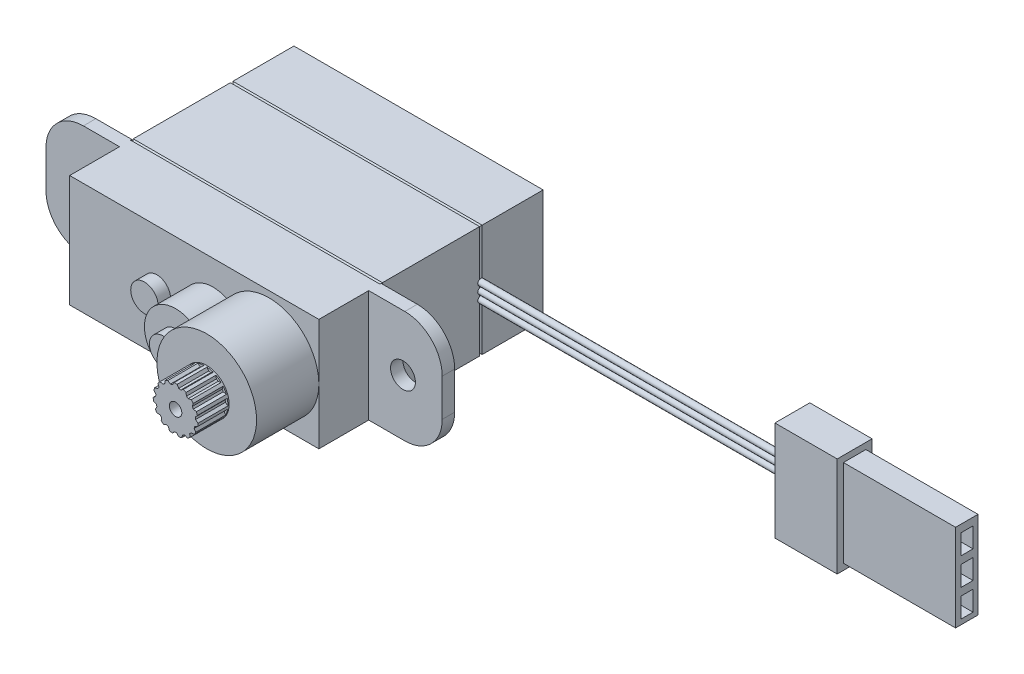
SolidWorks part; units mm, degrees
ref_plane "前视基准面" through (0, 0, 0) normal (0, 0, 1) x (1, 0, 0)
ref_plane "上视基准面" through (0, 0, 0) normal (0, 1, 0) x (1, 0, 0)
ref_plane "右视基准面" through (0, 0, 0) normal (1, 0, 0) x (0, 0, -1)
sketch "草图1" plane through (0, 0, 0) normal (0, 0, 1) x (1, 0, 0)
  line L1 (-10, 4.5) -> (10, 4.5)
  line L2 (-10, 4.5) -> (-10, -4.5)
  line L3 (-10, -4.5) -> (10, -4.5)
  line L4 (10, 4.5) -> (10, -4.5)
  dimension "D1" = 4.5
  dimension "D2" = 9
  dimension "D3" = 10
  dimension "D4" = 20
extrude "凸台-拉伸1" add sketch "草图1" along normal blind 5
chamfer "倒角1" distance 0.1 angle 45 4 edges at (10, 0, 5) (0, -4.5, 5) (-10, 0, 5) (0, 4.5, 5)
sketch "草图2" plane through (0, 0, 5) normal (0, 0, 1) x (1, 0, 0)
  line L0 (10, -4.5) -> (-10, -4.5) construction
  line L1 (10, 4.5) -> (10, -4.5) construction
  line L2 (-10, -4.5) -> (-10, 4.5) construction
  line L3 (-10, 4.5) -> (10, 4.5) construction
  line L6 (10, -4.5) -> (-10, -4.5)
  line L12 (10, 4.5) -> (10, -4.5)
  line L13 (-10, -4.5) -> (-10, 4.5)
  line L14 (-10, 4.5) -> (10, 4.5)
extrude "凸台-拉伸2" add sketch "草图2" along normal blind 8
chamfer "倒角2" distance 0.1 angle 45 4 edges at (0, 4.5, 5) (10, 0, 5) (-10, 0, 5) (0, -4.5, 5)
chamfer "倒角3" distance 0.1 angle 45 4 edges at (0, -4.5, 13) (-10, 0, 13) (0, 4.5, 13) (10, 0, 13)
sketch "草图3" plane through (0, 0, 13) normal (0, 0, 1) x (1, 0, 0)
  line L0 (10, 4.5) -> (10, -4.5) construction
  line L1 (10, -4.5) -> (-10, -4.5) construction
  line L2 (-10, -4.5) -> (-10, 4.5) construction
  line L3 (-10, 4.5) -> (10, 4.5) construction
  line L4 (10, 4.5) -> (10, -4.5)
  line L5 (10, -4.5) -> (-10, -4.5)
  line L6 (-10, -4.5) -> (-10, 4.5)
  line L7 (-10, 4.5) -> (10, 4.5)
extrude "凸台-拉伸3" add sketch "草图3" along normal blind 5
chamfer "倒角4" distance 0.1 angle 45 4 edges at (-10, 0, 13) (0, 4.5, 13) (10, 0, 13) (0, -4.5, 13)
ref_plane "基准面1" through (0, 0, 13) normal (0, 0, 1) x (1, 0, 0)
sketch "草图4" plane through (0, 0, 13) normal (0, 0, 1) x (1, 0, 0)
  line L2 (-15.9, 4.5) -> (-15.9, -4.5)
  line L3 (10, -4.5) -> (15.9, -4.5)
  line L4 (15.9, 4.5) -> (15.9, -4.5)
  line L5 (-10, 4.5) -> (-15.9, 4.5)
  line L6 (-10, -4.5) -> (-15.9, -4.5)
  line L7 (10, 4.5) -> (15.9, 4.5)
  line L10 (10, -4.5) -> (10, 4.5) construction
  line L11 (10, -4.5) -> (10, 4.5)
  line L12 (-10, 4.5) -> (-10, -4.5) construction
  line L13 (-10, 4.5) -> (-10, -4.5)
  circle A0 centre (-12.75, 0) radius 1
  circle A1 centre (12.75, 0) radius 1
  point P0 (0, 4.5)
  point P1 (0, -7.4084)
  point P6 (-15.9, -7.4084)
  dimension "D5" = 2
extrude "凸台-拉伸4" add sketch "草图4" along normal blind 1
fillet "圆角1" radius 3 4 edges at (-15.9, -4.5, 13.5) (-15.9, 4.5, 13.5) (15.9, -4.5, 13.5) (15.9, 4.5, 13.5)
sketch "草图5" plane through (0, 0, 18) normal (0, 0, 1) x (1, 0, 0)
  arc A1 (2.6667, -2.2111) -> (2.6667, 2.2111) centre (6, 0) ccw
  arc A2 (2.6667, 2.2111) -> (2.6667, -2.2111) centre (1.5, 0) ccw
  dimension "D3" = 5
extrude "凸台-拉伸5" add sketch "草图5" along normal blind 3
sketch "草图6" plane through (0, 0, 21) normal (0, 0, 1) x (1, 0, 0)
  circle A0 centre (6, 0) radius 4
extrude "凸台-拉伸6" add sketch "草图6" along normal blind 2
sketch "草图7" plane through (0, 0, 21) normal (0, 0, 1) x (1, 0, 0)
  circle A0 centre (1.5, 0) radius 1.1
  dimension "D1" = 2.2
extrude "凸台-拉伸7" add sketch "草图7" along normal blind 1
sketch "草图8" plane through (0, 0, 18) normal (0, 0, 1) x (1, 0, 0)
  circle A0 centre (-3, 0) radius 1.1
  arc A1 (2.1067, 0.9176) -> (2.1067, -0.9176) centre (1.5, 0) ccw construction
  dimension "D1" = 4.5
  dimension "D2" = 2.2
extrude "凸台-拉伸8" add sketch "草图8" along normal blind 1
sketch "草图9" plane through (0, 0, 23) normal (0, 0, 1) x (1, 0, 0)
  circle A0 centre (6, 0) radius 1.8
  dimension "D1" = 3.6
extrude "凸台-拉伸9" add sketch "草图9" along normal blind 2.5
sketch "草图10" plane through (0, 0, 25.5) normal (0, 0, 1) x (1, 0, 0)
  circle A0 centre (6, 0) radius 0.5
  dimension "D1" = 1
extrude "切除-拉伸1" cut sketch "草图10" against normal blind 5
sketch "草图11" plane through (0, 0, 25.5) normal (0, 0, 1) x (1, 0, 0)
  line L1 (6.25, 1.5803) -> (6.12, 1.796)
  line L2 (6.8712, 1.342) -> (6.8401, 1.5919)
  line L3 (5.75, 1.5803) -> (5.88, 1.796)
  line L4 (6.4144, 1.5454) -> (6.6209, 1.6895)
  line L5 (7.3417, 0.8717) -> (7.415, 1.1126)
  line L6 (7.0071, 1.2432) -> (7.2544, 1.2909)
  line L7 (7.5803, 0.2506) -> (7.7452, 0.4409)
  line L8 (7.4257, 0.7261) -> (7.671, 0.6691)
  line L9 (7.5456, -0.4138) -> (7.7736, -0.3071)
  line L10 (7.5978, 0.0834) -> (7.7987, -0.0684)
  line L11 (7.2436, -1.0067) -> (7.4954, -1.0019)
  line L12 (7.4936, -0.5737) -> (7.6154, -0.7941)
  line L13 (6.7267, -1.4255) -> (6.9586, -1.5235)
  line L14 (7.1312, -1.1316) -> (7.1527, -1.3825)
  line L15 (6.084, -1.5978) -> (6.256, -1.7817)
  line L16 (6.5731, -1.4938) -> (6.4908, -1.7318)
  line L17 (5.4269, -1.4938) -> (5.5092, -1.7318)
  line L18 (5.916, -1.5978) -> (5.744, -1.7817)
  line L19 (4.8688, -1.1316) -> (4.8473, -1.3825)
  line L20 (5.2733, -1.4255) -> (5.0414, -1.5235)
  line L21 (4.5064, -0.5737) -> (4.3846, -0.7941)
  line L22 (4.7564, -1.0067) -> (4.5046, -1.0019)
  line L23 (4.4022, 0.0834) -> (4.2013, -0.0684)
  line L24 (4.4544, -0.4138) -> (4.2264, -0.3071)
  line L25 (4.5743, 0.7261) -> (4.329, 0.6691)
  line L26 (4.4197, 0.2506) -> (4.2548, 0.4409)
  line L27 (4.9929, 1.2432) -> (4.7456, 1.2909)
  line L28 (4.6583, 0.8717) -> (4.585, 1.1126)
  line L29 (5.5856, 1.5454) -> (5.3791, 1.6895)
  line L30 (5.1288, 1.342) -> (5.1599, 1.5919)
  arc A0 (5.75, 1.5803) -> (5.5856, 1.5454) centre (6, 0) ccw
  circle A1 centre (6, 0) radius 1.8 construction
  arc A2 (5.88, 1.796) -> (5.3791, 1.6895) centre (6, 0) ccw
  arc A3 (5.1288, 1.342) -> (4.9929, 1.2432) centre (6, 0) ccw
  arc A4 (5.1599, 1.5919) -> (4.7456, 1.2909) centre (6, 0) ccw
  arc A5 (4.6583, 0.8717) -> (4.5743, 0.7261) centre (6, 0) ccw
  arc A6 (4.585, 1.1126) -> (4.329, 0.6691) centre (6, 0) ccw
  arc A7 (4.4197, 0.2506) -> (4.4022, 0.0834) centre (6, 0) ccw
  arc A8 (4.2548, 0.4409) -> (4.2013, -0.0684) centre (6, 0) ccw
  arc A9 (4.4544, -0.4138) -> (4.5064, -0.5737) centre (6, 0) ccw
  arc A10 (4.2264, -0.3071) -> (4.3846, -0.7941) centre (6, 0) ccw
  arc A11 (4.7564, -1.0067) -> (4.8688, -1.1316) centre (6, 0) ccw
  arc A12 (4.5046, -1.0019) -> (4.8473, -1.3825) centre (6, 0) ccw
  arc A13 (5.2733, -1.4255) -> (5.4269, -1.4938) centre (6, 0) ccw
  arc A14 (5.0414, -1.5235) -> (5.5092, -1.7318) centre (6, 0) ccw
  arc A15 (5.916, -1.5978) -> (6.084, -1.5978) centre (6, 0) ccw
  arc A16 (5.744, -1.7817) -> (6.256, -1.7817) centre (6, 0) ccw
  arc A17 (6.5731, -1.4938) -> (6.7267, -1.4255) centre (6, 0) ccw
  arc A18 (6.4908, -1.7318) -> (6.9586, -1.5235) centre (6, 0) ccw
  arc A19 (7.1312, -1.1316) -> (7.2436, -1.0067) centre (6, 0) ccw
  arc A20 (7.1527, -1.3825) -> (7.4954, -1.0019) centre (6, 0) ccw
  arc A21 (7.4936, -0.5737) -> (7.5456, -0.4138) centre (6, 0) ccw
  arc A22 (7.6154, -0.7941) -> (7.7736, -0.3071) centre (6, 0) ccw
  arc A23 (7.5978, 0.0834) -> (7.5803, 0.2506) centre (6, 0) ccw
  arc A24 (7.7987, -0.0684) -> (7.7452, 0.4409) centre (6, 0) ccw
  arc A25 (7.4257, 0.7261) -> (7.3417, 0.8717) centre (6, 0) ccw
  arc A26 (7.671, 0.6691) -> (7.415, 1.1126) centre (6, 0) ccw
  arc A27 (7.0071, 1.2432) -> (6.8712, 1.342) centre (6, 0) ccw
  arc A28 (7.2544, 1.2909) -> (6.8401, 1.5919) centre (6, 0) ccw
  arc A29 (6.4144, 1.5454) -> (6.25, 1.5803) centre (6, 0) ccw
  arc A30 (6.6209, 1.6895) -> (6.12, 1.796) centre (6, 0) ccw
  point P70 (6, 0)
  dimension "D1" = 3.2
extrude "切除-拉伸2" cut sketch "草图11" against normal blind 2.4
sketch "草图12" plane through (10, 0, 0) normal (1, 0, 0) x (0, 0, -1)
  line L0 (-5, -4.4) -> (-5, 4.4) construction
  circle A0 centre (-5, 0) radius 0.25
  circle A1 centre (-5, 0.6) radius 0.25
  circle A2 centre (-5, -0.6) radius 0.25
  dimension "D1" = 0.5
  dimension "D2" = 0.5
  dimension "D3" = 0.5
  dimension "D4" = 0.6
  dimension "D5" = 0.6
extrude "凸台-拉伸10" add sketch "草图12" along normal blind 25
sketch "草图13" plane through (35, 0, 0) normal (1, 0, 0) x (0, 0, -1)
  line L1 (-6.4, 4) -> (-3.6, 4)
  line L2 (-6.4, 4) -> (-6.4, -4)
  line L3 (-6.4, -4) -> (-3.6, -4)
  line L4 (-3.6, 4) -> (-3.6, -4)
  dimension "D2" = 2.8
extrude "凸台-拉伸11" add sketch "草图13" along normal blind 5
sketch "草图14" plane through (40, 0, 0) normal (1, 0, 0) x (0, 0, -1)
  line L5 (-5.4463, 2.9) -> (-4.5, 2.9)
  line L6 (-5.4463, 2.9) -> (-5.4463, 1.3)
  line L7 (-5.4463, 1.3) -> (-4.5, 1.3)
  line L16 (-5.9, 3.5) -> (-5.9, -3.5)
  line L17 (-5.9, -3.5) -> (-4.1, -3.5)
  line L18 (-4.1, -3.5) -> (-4.1, 3.5)
  line L19 (-4.1, 3.5) -> (-5.9, 3.5)
  line L20 (-5.9, 3.5) -> (-5.9, -3.5)
  line L21 (-5.9, -3.5) -> (-4.1, -3.5)
  line L22 (-4.1, -3.5) -> (-4.1, 3.5)
  line L23 (-4.1, 3.5) -> (-5.9, 3.5)
  line L24 (-4.5, 2.9) -> (-4.5, 1.3)
  line L25 (-5.4463, 0.7) -> (-4.5, 0.7)
  line L26 (-5.4463, 0.7) -> (-5.4463, -0.9)
  line L27 (-5.4463, -0.9) -> (-4.5, -0.9)
  line L28 (-4.5, 0.7) -> (-4.5, -0.9)
  line L29 (-5.4463, -1.5) -> (-4.5, -1.5)
  line L30 (-5.4463, -1.5) -> (-5.4463, -3.1)
  line L31 (-5.4463, -3.1) -> (-4.5, -3.1)
  line L32 (-4.5, -1.5) -> (-4.5, -3.1)
  dimension "D1" = 1.6
  dimension "D3" = 1.6
  dimension "D4" = 1.6
  dimension "D5" = 0.6
  dimension "D6" = 0.6
  dimension "D7" = 0.6
  dimension "D8" = 0.4
  dimension "D9" = 0.4
  dimension "D10" = 0.4
  dimension "D2" = 0.5
extrude "凸台-拉伸12" add sketch "草图14" along normal blind 9
sketch "草图15" plane through (0, 0, 0) normal (0, 0, -1) x (-1, 0, 0)
  line L10 (-8.9, -3.4) -> (-8.3577, -3.4)
  line L11 (-9.1, -3.6) -> (-9.1, -4.1423)
  line L13 (-8.9, -3.6) -> (-8.9, -4.1423)
  line L14 (9.1, 3.4) -> (9.1, 2.8577)
  line L15 (-8.9, -3.6) -> (-8.3577, -3.6)
  line L16 (9.1, 3.6) -> (9.6423, 3.6)
  line L17 (-8.9, -2.8577) -> (-8.9, -3.4)
  line L19 (-9.1, -2.8577) -> (-9.1, -3.4)
  line L20 (8.9, 3.4) -> (8.9, 2.8577)
  line L22 (-9.6423, -3.6) -> (-9.1, -3.6)
  line L23 (-9.6423, -3.4) -> (-9.1, -3.4)
  line L24 (9.1, 3.4) -> (9.6423, 3.4)
  line L29 (9.1, 4.1423) -> (9.1, 3.6)
  line L30 (8.9, 4.1423) -> (8.9, 3.6)
  line L31 (8.3577, 3.4) -> (8.9, 3.4)
  line L32 (8.3577, 3.6) -> (8.9, 3.6)
  circle A0 centre (-9, -3.5) radius 0.75
  circle A1 centre (9, 3.5) radius 0.75
  arc A2 (-9.6423, -3.4) -> (-9.6423, -3.6) centre (-9, -3.5) ccw
  arc A3 (-8.9, -2.8577) -> (-9.1, -2.8577) centre (-9, -3.5) ccw
  arc A4 (-8.3577, -3.6) -> (-8.3577, -3.4) centre (-9, -3.5) ccw
  arc A5 (-9.1, -4.1423) -> (-8.9, -4.1423) centre (-9, -3.5) ccw
  arc A6 (9.1, 4.1423) -> (8.9, 4.1423) centre (9, 3.5) ccw
  arc A7 (8.3577, 3.6) -> (8.3577, 3.4) centre (9, 3.5) ccw
  arc A8 (8.9, 2.8577) -> (9.1, 2.8577) centre (9, 3.5) ccw
  arc A9 (9.6423, 3.4) -> (9.6423, 3.6) centre (9, 3.5) ccw
  point P17 (-9.1, -2.75)
  point P18 (-9.1, -4.4749)
  point P19 (-9.8463, -3.6)
  point P20 (-7.9188, -3.6)
  point P21 (-8.9, -2.75)
  point P22 (-8.9, -4.4749)
  point P23 (-9.8463, -3.4)
  point P24 (-7.9188, -3.4)
  point P31 (8.25, 3.4)
  point P36 (9.9284, 3.4)
  point P38 (8.9, 4.25)
  point P40 (8.9, 2.3773)
  point P42 (8.25, 3.6)
  point P43 (9.9284, 3.6)
  point P44 (9.1, 4.25)
  point P45 (9.1, 2.3773)
extrude "凸台-拉伸13" add sketch "草图15" along normal blind 0.1
